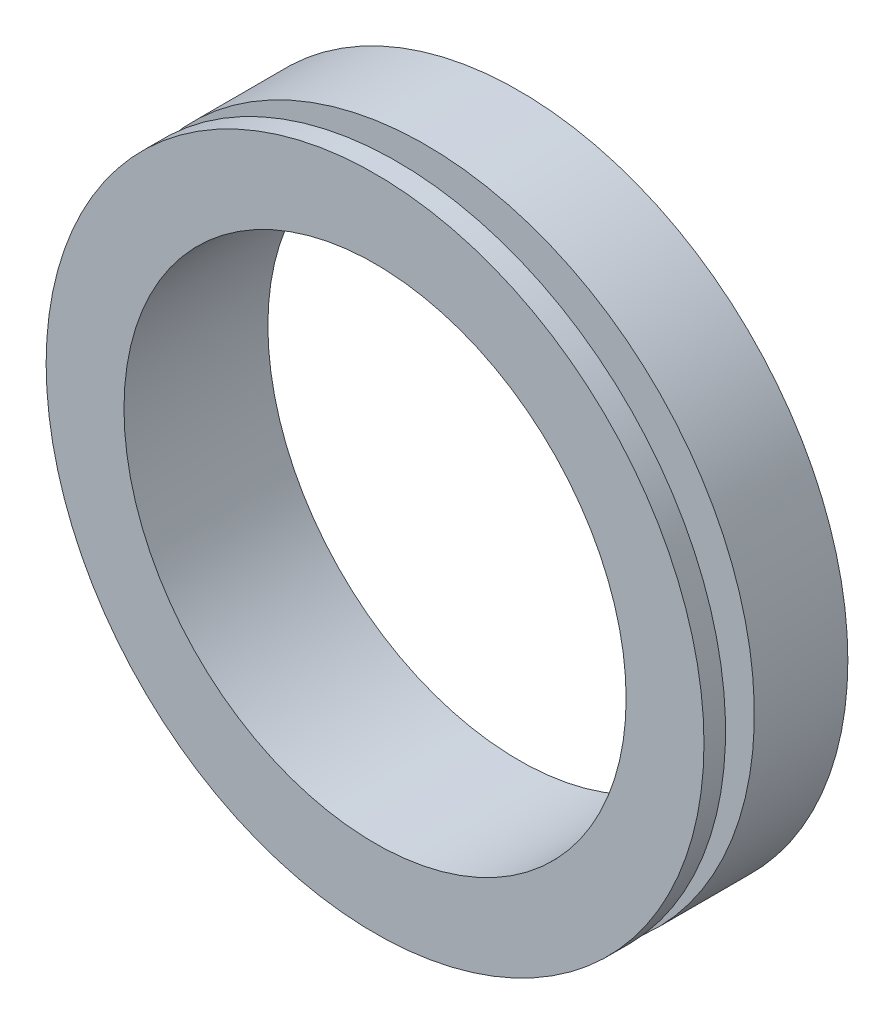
SolidWorks part; units mm, degrees
ref_plane "Front Plane" through (0, 0, 0) normal (0, 0, 1) x (1, 0, 0)
ref_plane "Top Plane" through (0, 0, 0) normal (0, 1, 0) x (1, 0, 0)
ref_plane "Right Plane" through (0, 0, 0) normal (1, 0, 0) x (0, 0, -1)
sketch "Sketch1" plane through (0, 0, 0) normal (0, 0, 1) x (1, 0, 0)
  circle A0 centre (0, 0) radius 8.7249
  circle A1 centre (0, 0) radius 11.43
  dimension "D1" = 17.4498
  dimension "D2" = 22.86
extrude "Boss-Extrude1" add sketch "Sketch1" along normal blind 5
sketch "Sketch2" plane through (0, 0, 0) normal (0, 1, 0) x (1, 0, 0)
  line L0 (0, 2.1898) -> (0, -6.2479) construction
  line L1 (-11.8618, -3.25) -> (11.901, -3.25) construction
  line L2 (11.43, 0) -> (-11.43, 0) construction
  line L3 (11.43, -5) -> (11.43, 0) construction
  line L4 (9.93, -3.25) -> (11.43, -3.25)
  line L5 (9.93, -3.25) -> (9.93, -4.25)
  line L6 (9.93, -4.25) -> (11.43, -4.25)
  line L7 (11.43, -3.25) -> (11.43, -4.25)
  dimension "D1" = 3.25
  dimension "D2" = 1.5
  dimension "D3" = 1
revolve "Cut-Revolve1" cut sketch "Sketch2" angle 360 about L0
